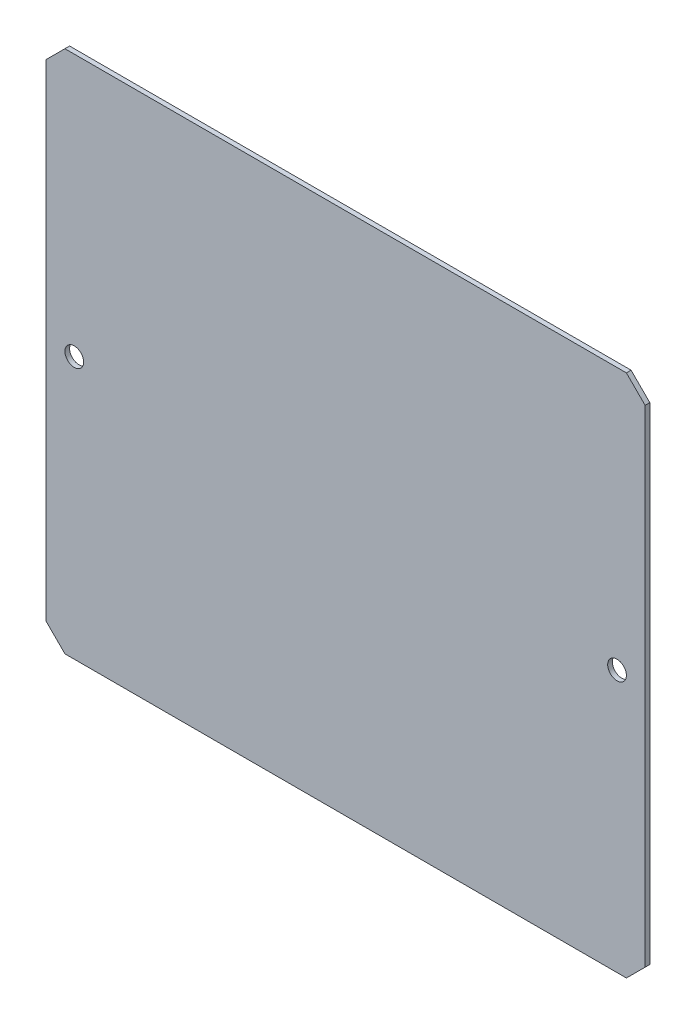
SolidWorks part; units mm, degrees
ref_plane "Face" through (0, 0, 0) normal (0, 0, 1) x (1, 0, 0)
ref_plane "Dessus" through (0, 0, 0) normal (0, 1, 0) x (1, 0, 0)
ref_plane "Droite" through (0, 0, 0) normal (1, 0, 0) x (0, 0, -1)
sketch "Esquisse1" plane through (0, 0, 0) normal (0, 0, 1) x (1, 0, 0)
  line L1 (-33.0997, 31.5951) -> (30.9003, 31.5951)
  line L2 (-33.0997, 31.5951) -> (-33.0997, -24.4049)
  line L3 (-33.0997, -24.4049) -> (30.9003, -24.4049)
  line L4 (30.9003, 31.5951) -> (30.9003, -24.4049)
  dimension "D1" = 64
  dimension "D2" = 56
extrude "Extrusion1" add sketch "Esquisse1" along normal blind 0.5
sketch "Esquisse2" plane through (0, 0, 0) normal (0, 0, -1) x (-1, 0, 0)
  line L0 (-30.9003, 3.5951) -> (33.0997, 3.5951) construction
  line L1 (-30.9003, -24.4049) -> (-30.9003, 31.5951) construction
  line L2 (33.0997, 31.5951) -> (33.0997, -24.4049) construction
  line L3 (1.0997, 31.5951) -> (1.0997, -24.4049) construction
  line L4 (-30.9003, 31.5951) -> (33.0997, 31.5951) construction
  line L5 (33.0997, -24.4049) -> (-30.9003, -24.4049) construction
  circle A0 centre (-27.9003, 3.5951) radius 1
  circle A1 centre (30.0997, 3.5951) radius 1
  dimension "D1" = 2
  dimension "D2" = 2
  dimension "D3" = 29
  dimension "D4" = 29
chamfer "Chanfrein1" distance 2 angle 45 1 edges at (-33.0997, 31.5951, 0.25)
chamfer "Chanfrein2" distance 2 angle 45 2 edges at (30.9003, 31.5951, 0.25) (30.9003, -24.4049, 0.25)
chamfer "Chanfrein3" distance 2 angle 45 1 edges at (-33.0997, -24.4049, 0.25)
extrude "Enlèv. mat.-Extru.1" cut sketch "Esquisse2" against normal blind 10
